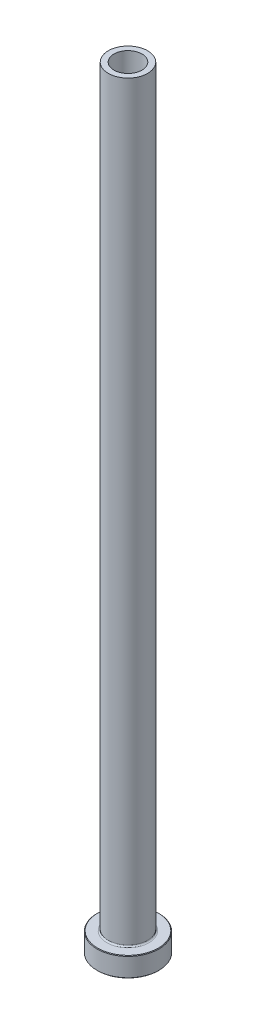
SolidWorks part; units mm, degrees
ref_plane "Front Plane" through (0, 0, 0) normal (0, 0, 1) x (1, 0, 0)
ref_plane "Top Plane" through (0, 0, 0) normal (0, 1, 0) x (1, 0, 0)
ref_plane "Right Plane" through (0, 0, 0) normal (1, 0, 0) x (0, 0, -1)
sketch "Sketch1" plane through (0, 0, 0) normal (0, 0, 1) x (1, 0, 0)
  line L0 (-5, 275) -> (-7, 275)
  line L1 (-7, 275) -> (-7, 7)
  line L2 (-7, 7) -> (-11, 7)
  line L3 (-11, 7) -> (-11, 0)
  line L4 (12.1, 0) -> (-12.1, 0) construction
  line L5 (-11, 0) -> (-5.25, 0)
  line L6 (-5, 230) -> (-5, 275)
  line L7 (0, 92.1877) -> (0, -15.5353) construction
  line L8 (0, -12.1) -> (0, 12.1) construction
  line L9 (-5, 230) -> (-5.25, 218)
  line L10 (-5.25, 218) -> (-5.25, 0)
  dimension "D1" = 0.25
  dimension "ID" = 10
  dimension "OD" = 14
  dimension "L" = 275
  dimension "H" = 22
  dimension "T" = 7
  dimension "N" = 45
  dimension "D2" = 12
revolve "Revolve1" add sketch "Sketch1" angle 360 about L7
fillet "Fillet1" radius 0.5 1 edges at (0, 7, 7)
chamfer "Chamfer1" distance 0.2 angle 45 2 edges at (0, 7, 11) (0, 0, 11)
chamfer "Chamfer3" distance 0.5 angle 45 1 edges at (0, 0, 5.25)
